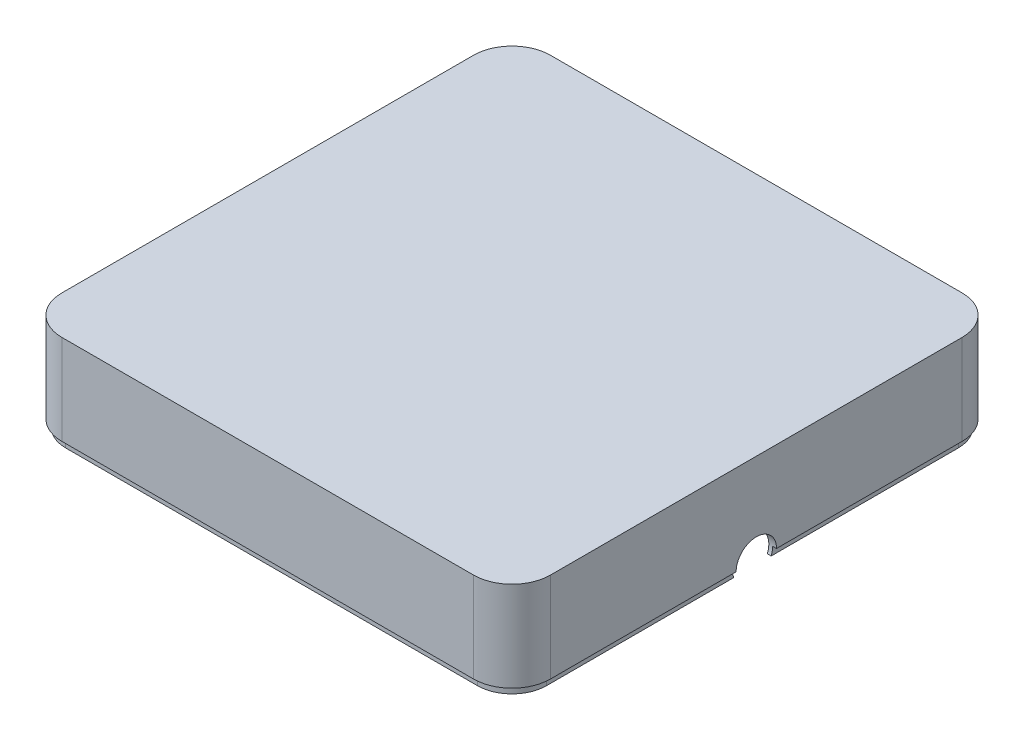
SolidWorks part; units mm, degrees
ref_plane "Front" through (0, 0, 0) normal (0, 0, 1) x (1, 0, 0)
ref_plane "Top" through (0, 0, 0) normal (0, 1, 0) x (1, 0, 0)
ref_plane "Right" through (0, 0, 0) normal (1, 0, 0) x (0, 0, -1)
sketch "Sketch1" plane through (0, 0, 0) normal (0, 0, 1) x (1, 0, 0)
  line L1 (0, 0) -> (127, 0)
  line L2 (0, 0) -> (0, -25.4)
  line L3 (0, -25.4) -> (127, -25.4)
  line L4 (127, 0) -> (127, -25.4)
  dimension "D1" = 127
  dimension "D2" = 25.4
extrude "Boss-Extrude1" add sketch "Sketch1" along normal blind 127
fillet "Fillet1" radius 10 4 edges at (0, -12.7, 127) (0, -12.7, 0) (127, -12.7, 0) (127, -12.7, 127)
shell "Shell1" thickness 2
sketch "Sketch3" plane through (0, -25.4, 0) normal (0, -1, 0) x (1, 0, 0)
  line L4 (117, 127) -> (10, 127)
  line L5 (0, 117) -> (0, 10)
  line L6 (10, 0) -> (117, 0)
  line L7 (127, 10) -> (127, 117)
  line L8 (117, 127) -> (10, 127)
  line L9 (0, 117) -> (0, 10)
  line L10 (10, 0) -> (117, 0)
  line L11 (127, 10) -> (127, 117)
  line L16 (117, 126) -> (10, 126)
  line L17 (1, 117) -> (1, 10)
  line L18 (10, 1) -> (117, 1)
  line L19 (126, 10) -> (126, 117)
  line L20 (117, 126) -> (10, 126)
  line L21 (1, 117) -> (1, 10)
  line L22 (10, 1) -> (117, 1)
  line L23 (126, 10) -> (126, 117)
  arc A4 (10, 127) -> (0, 117) centre (10, 117) ccw
  arc A5 (0, 10) -> (10, 0) centre (10, 10) ccw
  arc A6 (117, 0) -> (127, 10) centre (117, 10) ccw
  arc A7 (127, 117) -> (117, 127) centre (117, 117) ccw
  arc A8 (10, 127) -> (0, 117) centre (10, 117) ccw
  arc A9 (0, 10) -> (10, 0) centre (10, 10) ccw
  arc A10 (117, 0) -> (127, 10) centre (117, 10) ccw
  arc A11 (127, 117) -> (117, 127) centre (117, 117) ccw
  arc A16 (10, 126) -> (1, 117) centre (10, 117) ccw
  arc A17 (1, 10) -> (10, 1) centre (10, 10) ccw
  arc A18 (117, 1) -> (126, 10) centre (117, 10) ccw
  arc A19 (126, 117) -> (117, 126) centre (117, 117) ccw
  arc A20 (10, 126) -> (1, 117) centre (10, 117) ccw
  arc A21 (1, 10) -> (10, 1) centre (10, 10) ccw
  arc A22 (117, 1) -> (126, 10) centre (117, 10) ccw
  arc A23 (126, 117) -> (117, 126) centre (117, 117) ccw
  dimension "D1" = 0
  dimension "D2" = 1
extrude "Cut-Extrude1" cut sketch "Sketch3" against normal blind 2
sketch "Sketch5" plane through (127, 0, 0) normal (1, 0, 0) x (0, 0, -1)
  line L0 (-10, -23.4) -> (-117, -23.4) construction
  circle A0 centre (-63.5, -23.4) radius 5.25
extrude "Cut-Extrude3" cut sketch "Sketch5" against normal blind 4
sketch "Sketch6" plane through (0, 0, 0) normal (0, 0, -1) x (-1, 0, 0)
  line L1 (-23.2148, -42.6075) -> (-38.2148, -42.6075)
  line L2 (-23.2148, -42.6075) -> (-23.2148, -7.6075)
  line L3 (-23.2148, -7.6075) -> (-38.2148, -7.6075)
  line L4 (-38.2148, -42.6075) -> (-38.2148, -7.6075)
extrude "Cut-Extrude4" cut sketch "Sketch6" against normal up to next
